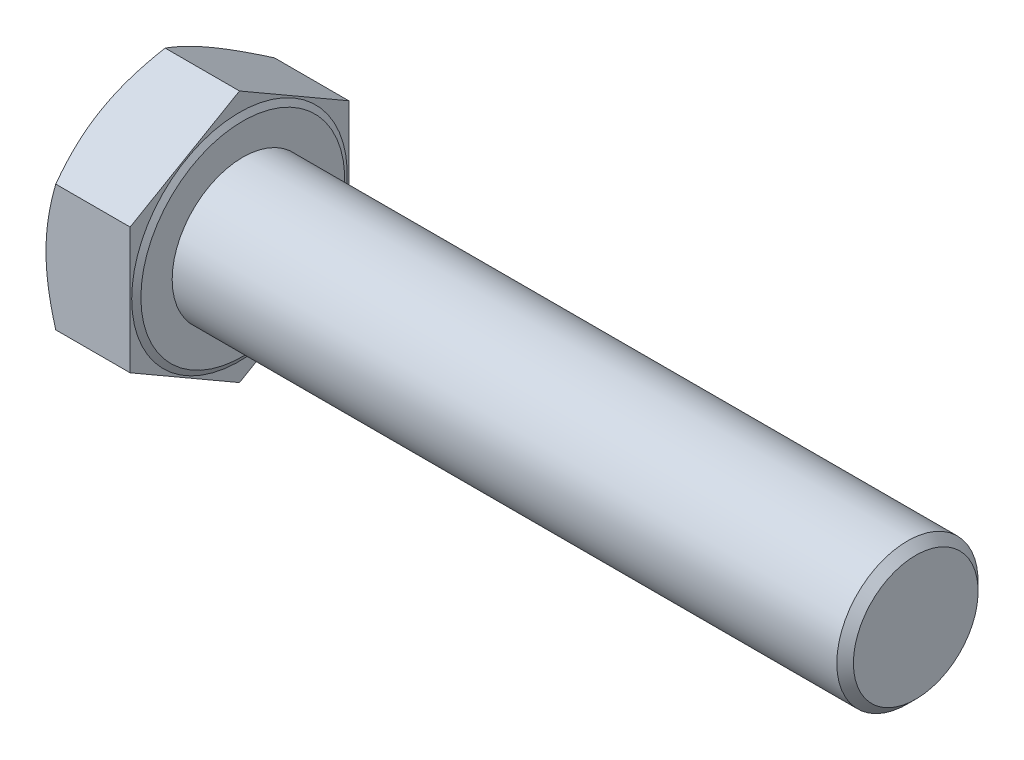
SolidWorks part; units mm, degrees
extrude "BaseHead" add sketch "HeadSke" along normal blind 26
sketch "HeadSke" plane through (0, 0, 0) normal (1, 0, 0) x (0, 0, -1)
  line L0 (32.5, 18.7639) -> (32.5, -18.7639)
  line L1 (-32.5, 18.7639) -> (-32.5, -18.7639)
  line L2 (32.5, -18.7639) -> (0, -37.5278)
  line L3 (0, -37.5278) -> (-32.5, -18.7639)
  line L4 (32.5, 18.7639) -> (0, 37.5278)
  line L5 (0, 37.5278) -> (-32.5, 18.7639)
  line L6 (0, 37.5278) -> (0, -37.5278) construction
  dimension "Width_flats" = 65
  dimension "D2" = 120
ref_plane "Plane1" through (0, 0, 0) normal (0, 0, 1) x (1, 0, 0)
ref_plane "Plane2" through (0, 0, 0) normal (0, 1, 0) x (1, 0, 0)
ref_plane "Plane3" through (0, 0, 0) normal (1, 0, 0) x (0, 0, -1)
sketch "BodySke" plane through (0, 0, 0) normal (0, 0, 1) x (1, 0, 0)
  line L0 (0, 18.7639) -> (0, -18.7639) construction
  line L1 (0, 0) -> (226, 0)
  line L2 (0, 0) -> (0, 21)
  line L3 (0, 21) -> (223.533, 21)
  line L4 (226, 0) -> (226, 18.533)
  line L5 (26, 37.5278) -> (26, 18.7639) construction
  line L6 (226, 18.533) -> (223.533, 21)
  line L7 (0, 0) -> (96.52, 0) construction
  line L8 (226, -18.533) -> (223.533, -21) construction
  line L9 (0, -21) -> (223.533, -21) construction
  line L10 (30.5, 15.24) -> (30.5, -1.27) construction
  line L11 (181, 15.24) -> (181, -13.0561) construction
  line L12 (26, 18.7639) -> (26, -18.7639) construction
revolve "BaseBody" add sketch "BodySke"
fillet "HeadFillet" [suppressed] radius 1.2
sketch "Sketch3" plane through (0, 0, 0) normal (0, 1, 0) x (1, 0, 0)
  line L0 (-8.125, 18.4271) -> (8.125, 46.5729)
  line L1 (0, 0) -> (0, -32.5) construction
  line L2 (0, 32.5) -> (0, 0) construction
  line L3 (-8.125, 18.4271) -> (-29.7756, 30.9271)
  line L4 (-29.7756, 30.9271) -> (-13.5256, 59.0729)
  line L5 (-13.5256, 59.0729) -> (8.125, 46.5729)
  line L6 (0, 0) -> (99.06, 0) construction
  point P11 (0, 32.5)
  dimension "D1" = 25
  dimension "Head_ch_ang" = 30
revolve "HeadChamfer" cut sketch "Sketch3" angle 360 about L6
sketch "BearingSke" plane through (0, 0, 0) normal (0, 0, 1) x (1, 0, 0)
  line L0 (26, 37.5278) -> (2.9028, 37.5278) construction
  line L1 (26, 37.5278) -> (26, 18.7639) construction
  line L2 (26, 30.3) -> (25, 32.0321)
  line L3 (26, 30.3) -> (26, 37.5278)
  line L4 (26, 37.5278) -> (25, 37.5278)
  line L5 (0, 0) -> (95.25, 0) construction
  line L6 (0, 0) -> (96.52, 0) construction
  line L7 (25, 32.0321) -> (25, 37.5278)
  dimension "D1" = 30
  dimension "Bearing_ht" = 1
  dimension "Bearing_dia" = 60.6
revolve "BearingFace" cut sketch "BearingSke" angle 360 about L5
sketch "ThdSchSke" plane through (0, 0, 0) normal (0, 0, 1) x (1, 0, 0)
  line L0 (185.5, -18.533) -> (183.7726, -21)
  line L1 (185.5, -18.533) -> (187.2274, -21)
  line L2 (187.2274, -21) -> (187.2274, -26.25)
  line L3 (-3.175, 0) -> (5.1513, 0) construction
  line L5 (187.2274, -26.25) -> (183.7726, -26.25)
  line L6 (183.7726, -26.25) -> (183.7726, -21)
revolve "ThreadSchematic" [suppressed] cut sketch "ThdSchSke" angle 360 about L3
pattern_linear "ThdSchPat" [suppressed]
equation "\"Thread_minor@ThreadCosmetic\" = \"Minor_dia@BodySke\""
equation "\"Thread_length@ThreadCosmetic\" = \"Thread_nom@BodySke\" - \"Advance@BodySke\""
equation "\"Thread_minor@ThdSchSke\" = \"Minor_dia@BodySke\""
equation "\"Diameter@ThdSchSke\" = \"Diameter@BodySke\""
equation "\"Overcut@ThdSchSke\" = \"Diameter@BodySke\" * 1.25"
equation "\"Start@ThdSchSke\" = \"Head_ht@BaseHead\" + \"Length@BodySke\" - \"Thread_length@ThreadCosmetic\"  '---Non-countersunk---"
equation "\"Num_threads@ThdSchPat\" = int( \"Thread_length@ThreadCosmetic\" / \"Advance@BodySke\" + 0.999 )  + 1"
equation "\"Advance@ThdSchPat\" = \"Thread_length@ThreadCosmetic\" /  (\"Num_threads@ThdSchPat\" - 1) 'relax it"
equation "\"Num_threads@ThdSchPat\" = \"Num_threads@ThdSchPat\" - sgn( \"Num_threads@ThdSchPat\" - 1) '---chamfered tips only---"
